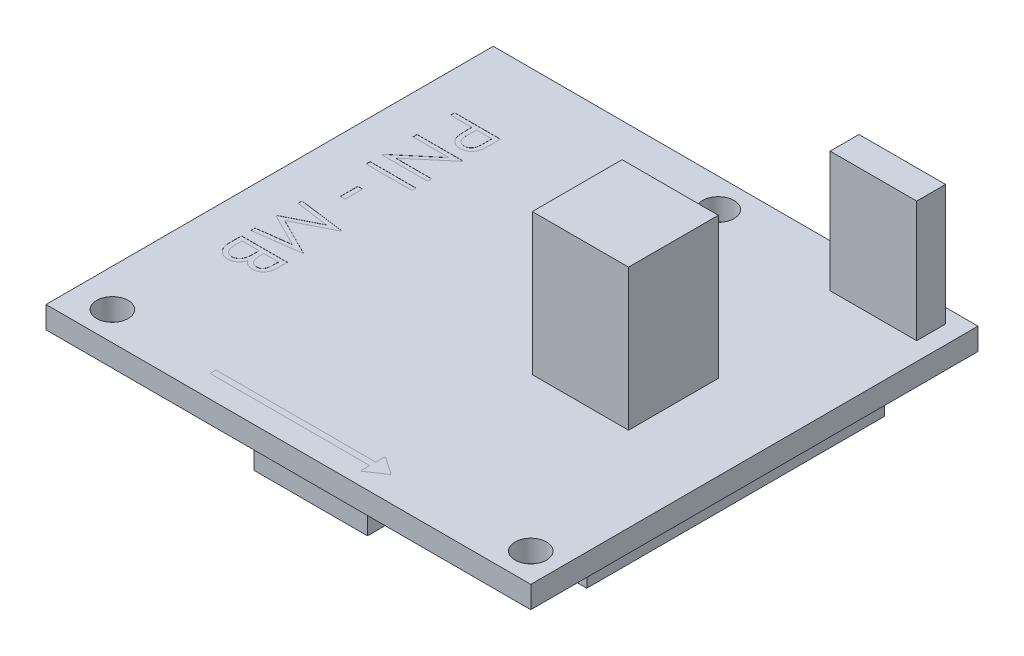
SolidWorks part; units mm, degrees
ref_plane "Front Plane" through (0, 0, 0) normal (0, 0, 1) x (1, 0, 0)
ref_plane "Top Plane" through (0, 0, 0) normal (0, 1, 0) x (1, 0, 0)
ref_plane "Right Plane" through (0, 0, 0) normal (1, 0, 0) x (0, 0, -1)
sketch "Sketch1" plane through (0, 0, 0) normal (0, 1, 0) x (1, 0, 0)
  line L0 (-16.8, 15.5) -> (16.8, -15.5) construction
  line L1 (-16.8, 15.5) -> (16.8, 15.5)
  line L2 (-16.8, 15.5) -> (-16.8, -15.5)
  line L3 (-16.8, -15.5) -> (16.8, -15.5)
  line L4 (16.8, 15.5) -> (16.8, -15.5)
  circle A0 centre (0.8, 13.5) radius 1.0922
  circle A1 centre (14.8, -13.5) radius 1.0922
  circle A2 centre (-14.2, -13.5) radius 1.0922
  dimension "D3" = 2.1844
  dimension "D4" = 2
  dimension "D6" = 2
  dimension "D7" = 2.6
  dimension "D8" = 0.9078
  dimension "D9" = 29
  dimension "D10" = 17.6
  dimension "D11" = 27
  dimension "31.0" = 31
  dimension "D2" = 33.6
extrude "Boss-Extrude1" add sketch "Sketch1" along normal blind 1.524
sketch "Sketch2" plane through (0, 1.524, 0) normal (0, 1, 0) x (1, 0, 0)
  line L1 (15.55, 14.5) -> (9.55, 14.5)
  line L2 (15.55, 14.5) -> (15.55, 12.5)
  line L3 (15.55, 12.5) -> (9.55, 12.5)
  line L4 (9.55, 14.5) -> (9.55, 12.5)
  line L6 (15.55, 13.5) -> (14.8, 13.5) construction
  line L7 (14.8, 14.5) -> (14.8, 12.5) construction
  line L8 (16.8, 15.5) -> (-16.8, 15.5) construction
  line L9 (16.8, -15.5) -> (16.8, 15.5) construction
  dimension "D1" = 0.75
  dimension "D2" = 6
  dimension "D3" = 2
  dimension "D4" = 2
  dimension "D5" = 2
extrude "Boss-Extrude2" add sketch "Sketch2" along normal blind 8.382
sketch "Sketch7" plane through (0, 1.524, 0) normal (0, 1, 0) x (1, 0, 0)
  line L1 (4.2644, 3.3665) -> (10.9365, 3.3665)
  line L2 (4.2644, 3.3665) -> (4.2644, -2.8585)
  line L3 (4.2644, -2.8585) -> (10.9365, -2.8585)
  line L4 (10.9365, 3.3665) -> (10.9365, -2.8585)
extrude "Boss-Extrude4" add sketch "Sketch7" along normal blind 9.79
sketch "Sketch3" plane through (0, 0, 0) normal (0, -1, 0) x (1, 0, 0)
  line L0 (15.5531, -10.2816) -> (2.4505, -10.2816)
  line L1 (2.4505, -10.2816) -> (2.4505, -9.8892)
  line L2 (2.4505, -9.8892) -> (-3.2378, -9.8892)
  line L3 (-3.2378, -9.8892) -> (-3.2378, -10.5465)
  line L4 (-3.2378, -10.5465) -> (-15.5422, -10.5465)
  line L5 (-15.5422, -10.5465) -> (-15.5422, 7.3136)
  line L6 (-15.5422, 7.3136) -> (-3.0581, 7.3136)
  line L7 (-3.0581, 7.3136) -> (-3.0581, 14.8237)
  line L8 (-3.0581, 14.8237) -> (4.8087, 14.8237)
  line L9 (4.8087, 14.8237) -> (4.8087, 10.3697)
  line L10 (4.8087, 10.3697) -> (15.5531, 10.3697)
  line L11 (15.5531, 10.3697) -> (15.5531, -10.2816)
extrude "Boss-Extrude3" add sketch "Sketch3" along normal blind 1.9
sketch "Sketch4" plane through (0, 0, 0) normal (0, 1, 0) x (1, 0, 0)
  line L0 (16.8, -15.5) -> (16.8, 15.5) construction
  line L5 (-16.8, 15.5) -> (-16.8, -15.5)
  line L6 (-16.8, -15.5) -> (16.8, -15.5)
  line L7 (16.8, -15.5) -> (16.8, 15.5)
  line L8 (16.8, 15.5) -> (-16.8, 15.5)
  line L9 (-16.8, 15.5) -> (-16.8, -15.5)
  line L10 (-16.8, -15.5) -> (16.8, -15.5)
  line L11 (16.8, -15.5) -> (16.8, 15.5)
  line L12 (16.8, 15.5) -> (-16.8, 15.5)
  point P0 (14.8, -13.5)
  point P1 (-14.2, -13.5)
  point P3 (0.8, 13.5)
  dimension "D1" = 2
  dimension "D2" = 29
  dimension "D3" = 16
  dimension "D4" = 27
  dimension "D5" = 0
sketch "Sketch5" plane through (0, -1.9, 0) normal (0, -1, 0) x (1, 0, 0)
  line L24 (12.4718, -7.2003) -> (12.4718, 7.2884)
  line L25 (12.4718, 7.2884) -> (1.7274, 7.2884)
  line L26 (1.7274, 7.2884) -> (1.7274, 11.7425)
  line L27 (1.7274, 11.7425) -> (0.0232, 11.7425)
  line L28 (0.0232, 11.7425) -> (0.0232, 4.2324)
  line L29 (0.0232, 4.2324) -> (-12.4609, 4.2324)
  line L30 (-12.4609, 4.2324) -> (-12.4609, -7.4652)
  line L31 (-12.4609, -7.4652) -> (-6.3191, -7.4652)
  line L32 (-6.3191, -7.4652) -> (-6.3191, -6.8079)
  line L33 (-6.3191, -6.8079) -> (5.5318, -6.8079)
  line L34 (5.5318, -6.8079) -> (5.5318, -7.2003)
  line L35 (5.5318, -7.2003) -> (12.4718, -7.2003)
  line L36 (12.4718, -7.2003) -> (12.4718, 7.2884)
  line L37 (12.4718, 7.2884) -> (1.7274, 7.2884)
  line L38 (1.7274, 7.2884) -> (1.7274, 11.7425)
  line L39 (1.7274, 11.7425) -> (0.0232, 11.7425)
  line L40 (0.0232, 11.7425) -> (0.0232, 4.2324)
  line L41 (0.0232, 4.2324) -> (-12.4609, 4.2324)
  line L42 (-12.4609, 4.2324) -> (-12.4609, -7.4652)
  line L43 (-12.4609, -7.4652) -> (-6.3191, -7.4652)
  line L44 (-6.3191, -7.4652) -> (-6.3191, -6.8079)
  line L45 (-6.3191, -6.8079) -> (5.5318, -6.8079)
  line L46 (5.5318, -6.8079) -> (5.5318, -7.2003)
  line L47 (5.5318, -7.2003) -> (12.4718, -7.2003)
  dimension "D1" = 3.0812
extrude "Cut-Extrude1" cut sketch "Sketch5" against normal blind 1.04
sketch "Sketch6" plane through (0, 1.524, 0) normal (0, 1, 0) x (1, 0, 0)
  line L0 (4.098, -13.7441) -> (5.3783, -13.7441) construction
  line L1 (-6.9767, -13.5367) -> (4.098, -13.5367)
  line L2 (-6.9767, -13.5367) -> (-6.9767, -13.9516)
  line L3 (-6.9767, -13.9516) -> (4.098, -13.9516)
  line L4 (4.098, -13.5367) -> (4.098, -13.9516) construction
  line L5 (5.3783, -13.7441) -> (4.098, -12.877)
  line L6 (5.3783, -13.7441) -> (4.098, -14.6112)
  line L7 (4.098, -14.6112) -> (4.098, -13.9516)
  line L8 (4.098, -12.877) -> (4.098, -13.5367)
sketch "Sketch8" plane through (0, 1.524, 0) normal (0, 1, 0) x (1, 0, 0)
  line L0 (-14.1445, 10.5805) -> (-14.1445, -8.031) construction
  text T0 "PNI - MB"
extrude "Cut-Extrude2" cut sketch "Sketch8" against normal blind 0.01
equation "\"Buoyancy\"=\"SW-Volume\"*(\"SW-Density\"-.037062)"
